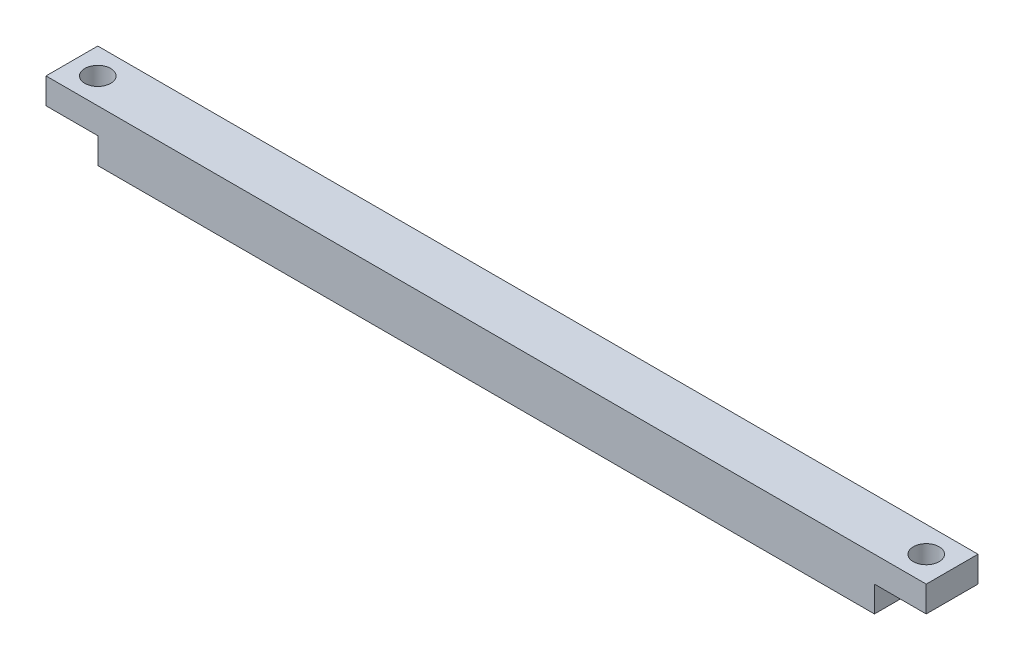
SolidWorks part; units mm, degrees
ref_plane "Plan de face" through (0, 0, 0) normal (0, 0, 1) x (1, 0, 0)
ref_plane "Plan de dessus" through (0, 0, 0) normal (0, 1, 0) x (1, 0, 0)
ref_plane "Plan de droite" through (0, 0, 0) normal (1, 0, 0) x (0, 0, -1)
sketch "Esquisse1" plane through (0, 0, 0) normal (0, 0, 1) x (1, 0, 0)
  line L0 (-160, 10) -> (-160, 5)
  line L2 (10, 10) -> (10, 5)
  line L3 (-160, 10) -> (10, 10)
  line L6 (-160, 5) -> (-150, 5)
  line L7 (-150, 5) -> (-150, 0)
  line L8 (-150, 0) -> (0, 0)
  line L9 (0, 0) -> (0, 5)
  line L10 (0, 5) -> (10, 5)
  dimension "D1" = 170
  dimension "D2" = 5
  dimension "D3" = 10
  dimension "D4" = 10
  dimension "D5" = 5
  dimension "D6" = 10
extrude "Boss.-Extru.1" add sketch "Esquisse1" along normal blind 10
sketch "Esquisse5" plane through (0, 5, 0) normal (0, -1, 0) x (-1, 0, 0)
  line L0 (150, -10) -> (150, 0) construction
  line L1 (160, 0) -> (150, 0) construction
  line L2 (0, 0) -> (-10, 0) construction
  line L3 (-10, -10) -> (-10, 0) construction
  circle A0 centre (155, -5) radius 2.5
  circle A1 centre (-5, -5) radius 2.5
  dimension "D2" = 5
  dimension "D3" = 5
  dimension "D4" = 5
  dimension "D5" = 5
  dimension "D6" = 5
  dimension "D1" = 5
extrude "Enlèv. mat.-Extru.6" cut sketch "Esquisse5" against normal through all
